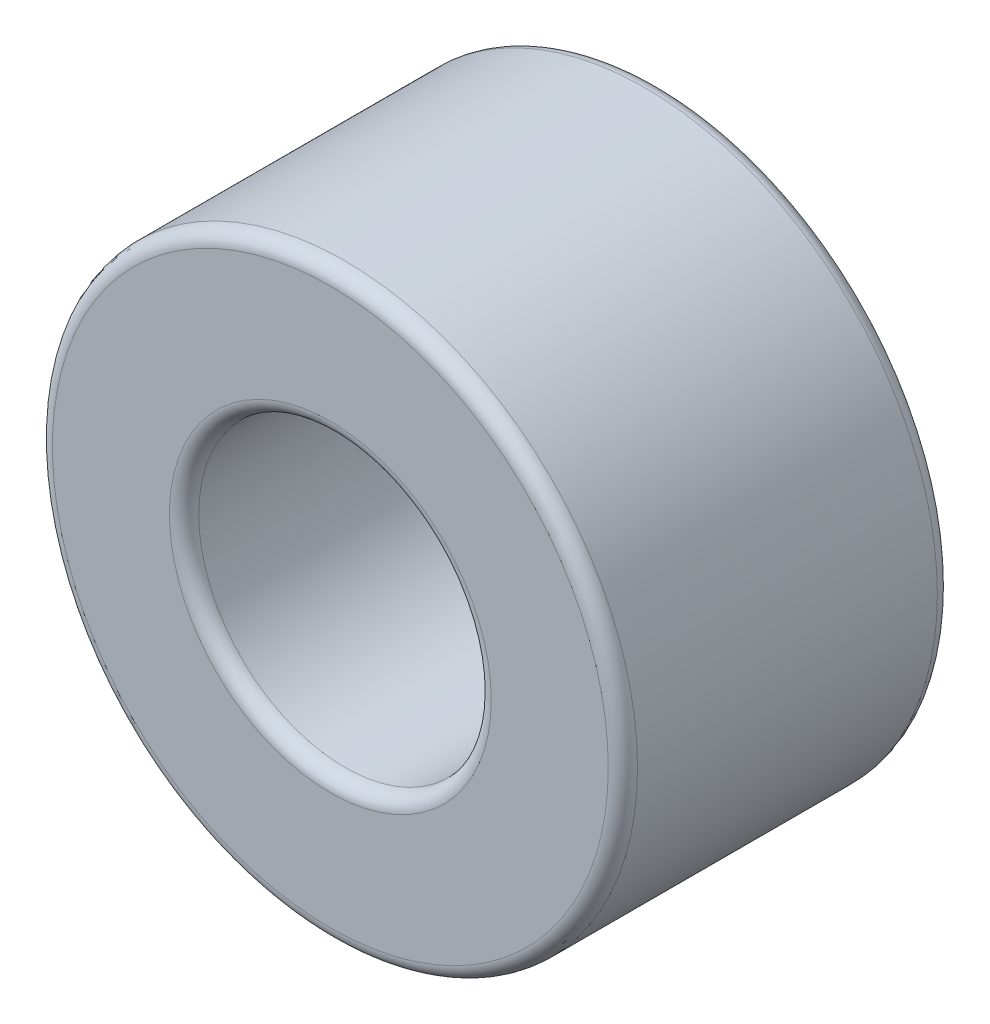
SolidWorks part; units mm, degrees
ref_plane "Face" through (0, 0, 0) normal (0, 0, 1) x (1, 0, 0)
ref_plane "Dessus" through (0, 0, 0) normal (0, 1, 0) x (1, 0, 0)
ref_plane "Droite" through (0, 0, 0) normal (1, 0, 0) x (0, 0, -1)
sketch "Esquisse1" plane through (0, 0, 0) normal (0, 0, 1) x (1, 0, 0)
  circle A0 centre (0, 0) radius 4
  circle A1 centre (0, 0) radius 2
  dimension "D1" = 4
  dimension "D2" = 8
extrude "Extrusion1" add sketch "Esquisse1" along normal blind 4.5
fillet "Congé1" radius 0.2
